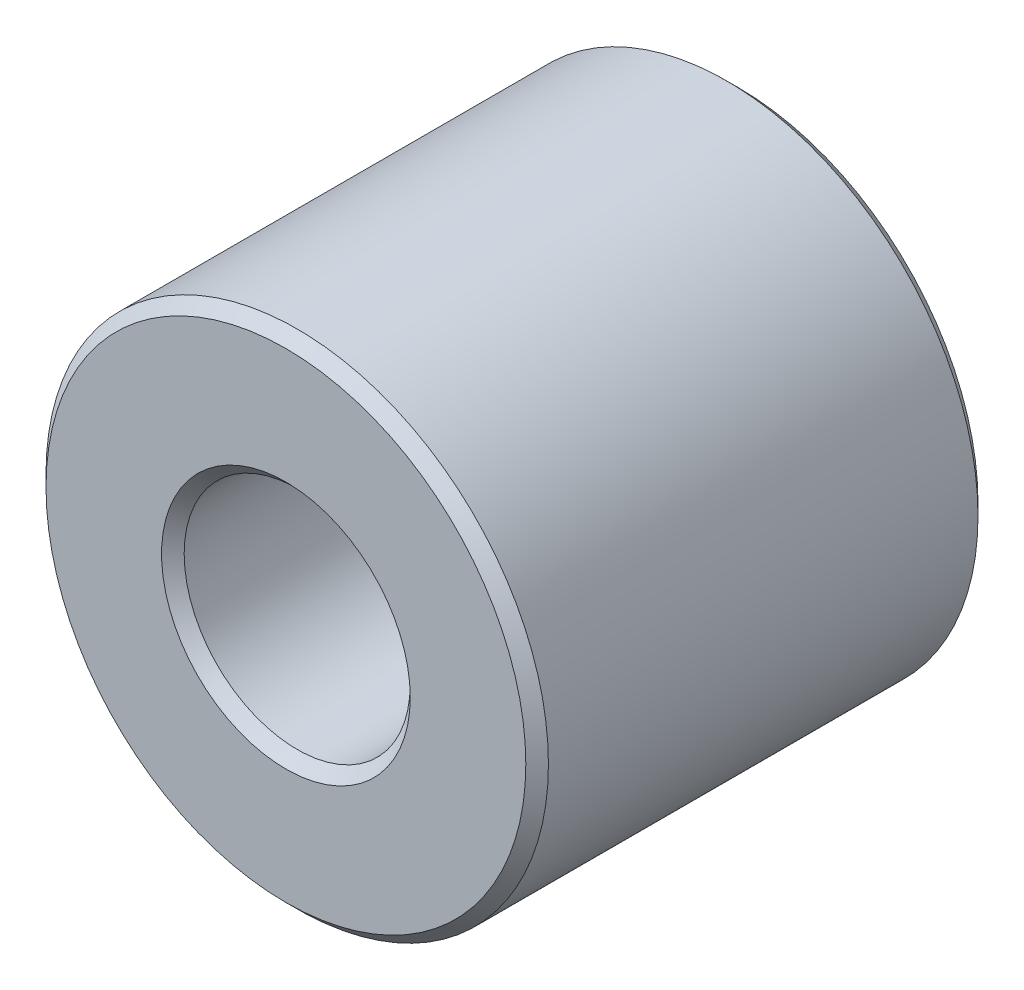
SolidWorks part; units mm, degrees
ref_plane "Front Plane" through (0, 0, 0) normal (0, 0, 1) x (1, 0, 0)
ref_plane "Top Plane" through (0, 0, 0) normal (0, 1, 0) x (1, 0, 0)
ref_plane "Right Plane" through (0, 0, 0) normal (1, 0, 0) x (0, 0, -1)
sketch "Sketch1" plane through (0, 0, 0) normal (0, 0, 1) x (1, 0, 0)
  circle A0 centre (0, 0) radius 9
  circle A1 centre (0, 0) radius 20
  dimension "D1" = 18
  dimension "D2" = 40
extrude "Boss-Extrude1" add sketch "Sketch1" along normal mid plane 36
chamfer "Chamfer1" distance 0.9 angle 45 4 edges at (9, 0, -18) (20, 0, -18) (9, 0, 18) (20, 0, 18)
